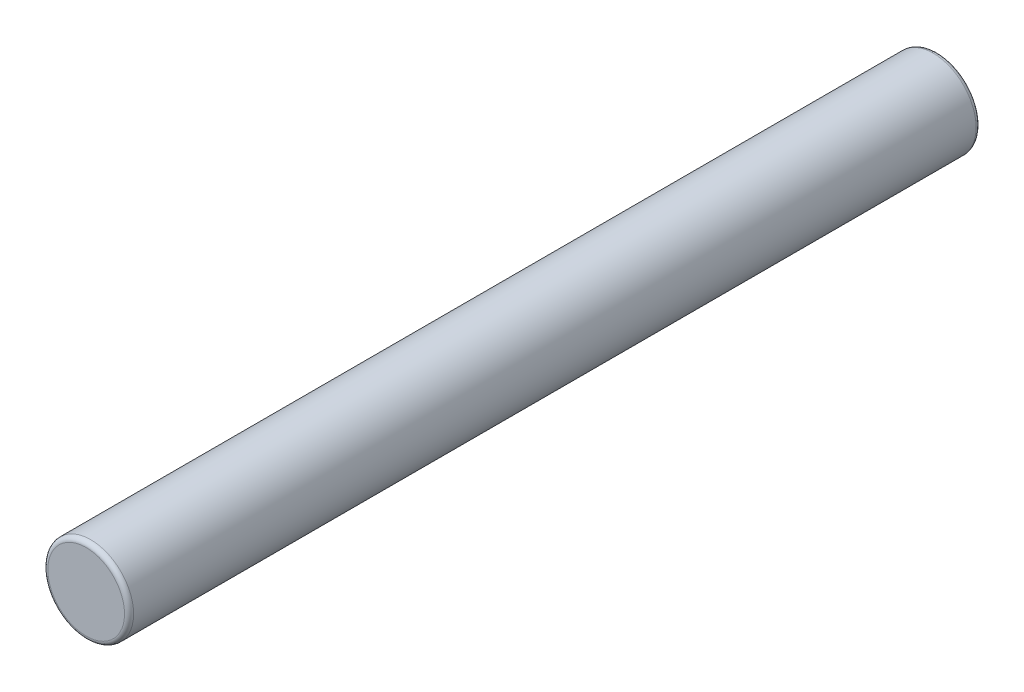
SolidWorks part; units mm, degrees
ref_plane "Front Plane" through (0, 0, 0) normal (0, 0, 1) x (1, 0, 0)
ref_plane "Top Plane" through (0, 0, 0) normal (0, 1, 0) x (1, 0, 0)
ref_plane "Right Plane" through (0, 0, 0) normal (1, 0, 0) x (0, 0, -1)
sketch "Sketch1" plane through (0, 0, 0) normal (0, 0, 1) x (1, 0, 0)
  circle A0 centre (0, 0) radius 1.2001
  dimension "D1" = 2.4003
extrude "Extrude1" add sketch "Sketch1" along normal mid plane 23.8252
fillet "Fillet1" radius 0.127 2 edges at (1.2001, 0, 11.9126) (1.2001, 0, -11.9126)
